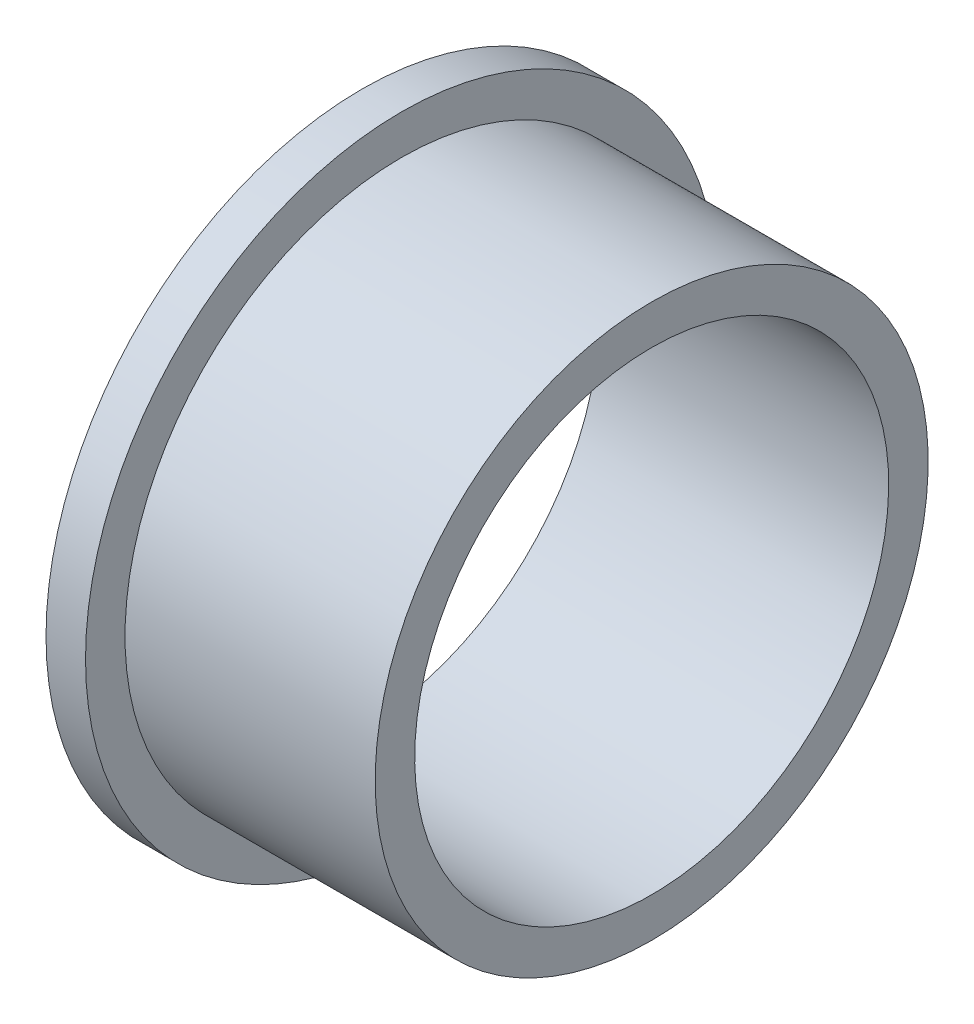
SolidWorks part; units mm, degrees
ref_plane "Piano frontale" through (0, 0, 0) normal (0, 0, 1) x (1, 0, 0)
ref_plane "Piano superiore" through (0, 0, 0) normal (0, 1, 0) x (1, 0, 0)
ref_plane "Piano destro" through (0, 0, 0) normal (1, 0, 0) x (0, 0, -1)
sketch "Schizzo1" plane through (0, 0, 0) normal (0, 0, 1) x (1, 0, 0)
  line L0 (0, 0) -> (-22, 0) construction
  line L1 (-22, 18) -> (-22, 24)
  line L2 (-22, 24) -> (-19, 24)
  line L3 (-19, 24) -> (-19, 21)
  line L4 (-19, 21) -> (0, 21)
  line L5 (0, 21) -> (0, 18)
  line L6 (0, 18) -> (-22, 18)
  point P10 (-20.5, 24)
  dimension "D1" = 36
  dimension "D2" = 3
  dimension "D3" = 19
  dimension "D4" = 3
  dimension "D5" = 48
revolve "Rivoluzione1" add sketch "Schizzo1" angle 360 about L0
sketch "Linee di piegatura1" [suppressed] plane through (0, 0, 0) normal (0, 1, 0) x (1, 0, 0)
sketch "Casella di contorno1" [suppressed] plane through (0, 0, 0) normal (0, 1, 0) x (1, 0, 0)
equation "\"Lam_vern\"= 2 * ( \"SW-Massa\" / \"SW-Densità\" ) / ( \"Spessore\" / 1000 )"
